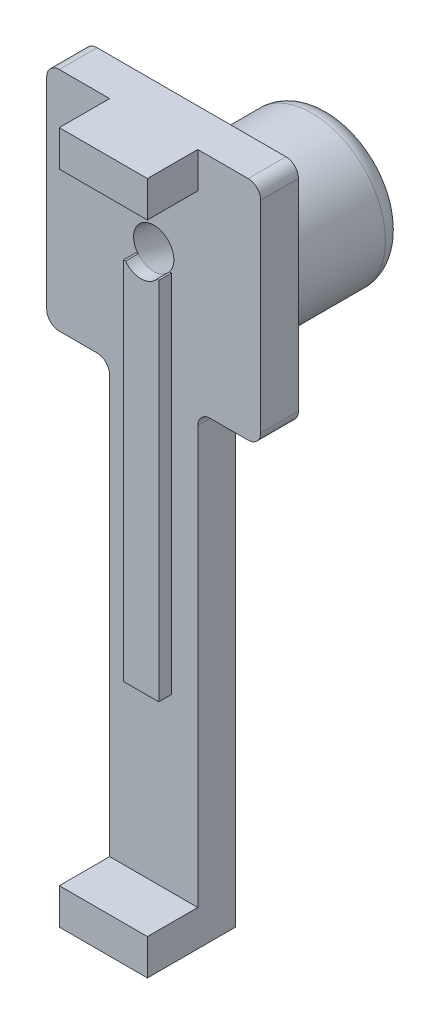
SolidWorks part; units mm, degrees
ref_plane "Front Plane" through (0, 0, 0) normal (0, 0, 1) x (1, 0, 0)
ref_plane "Top Plane" through (0, 0, 0) normal (0, 1, 0) x (1, 0, 0)
ref_plane "Right Plane" through (0, 0, 0) normal (1, 0, 0) x (0, 0, -1)
sketch "Sketch1" plane through (0, 0, 0) normal (0, 0, 1) x (1, 0, 0)
  line L1 (1.5, -15) -> (-1.5, -15)
  line L2 (1.5, -15) -> (1.5, 15)
  line L3 (1.5, 15) -> (-1.5, 15)
  line L4 (-1.5, -15) -> (-1.5, 15)
  line L5 (1.5, -15) -> (-1.5, 15) construction
  line L6 (1.5, 15) -> (-1.5, -15) construction
  line L7 (3.5, -18.4549) -> (-3.5, -18.4549)
  line L8 (3.5, -18.4549) -> (3.5, 36.5451)
  line L9 (3.5, 36.5451) -> (-3.5, 36.5451)
  line L10 (-3.5, -18.4549) -> (-3.5, 36.5451)
  line L11 (3.5, -18.4549) -> (-3.5, 36.5451) construction
  line L12 (3.5, 36.5451) -> (-3.5, -18.4549) construction
  point P0 (0, 0)
  point P6 (0, 9.0451)
  dimension "D1" = 3
  dimension "D2" = 30
  dimension "D3" = 55
  dimension "D4" = 7
extrude "Boss-Extrude1" add sketch "Sketch1" along normal blind 3 contours L10 L7 L8 L9 L1 L4 L3 L2 | L4 L1 L2 L3
sketch "Sketch2" plane through (0, 0, 3) normal (0, 0, 1) x (1, 0, 0)
  line L0 (3.5, -18.4549) -> (-3.5, -18.4549) construction
  line L1 (0, -2.0049) -> (0, -18.4549) construction
  line L16 (-1.4, -2.0049) -> (1.4, -2.0049)
  line L17 (-1.4, 26.9951) -> (-1.4, -2.0049)
  line L18 (1.4, 26.9951) -> (-1.4, 26.9951)
  line L19 (1.4, -2.0049) -> (1.4, 26.9951)
  point P0 (0, -2.0049)
  dimension "D1" = 16.45
  dimension "D2" = 29
  dimension "D3" = 2.8
extrude "Boss-Extrude2" add sketch "Sketch2" along normal blind 1
sketch "Sketch3" plane through (0, 0, 3) normal (0, 0, 1) x (1, 0, 0)
  line L0 (3.5, -18.4549) -> (3.5, 36.5451) construction
  line L1 (-3.5, 36.5451) -> (3.5, 36.5451)
  line L2 (-3.5, 36.5451) -> (-3.5, 33.6951)
  line L3 (-3.5, 33.6951) -> (3.5, 33.6951)
  line L4 (3.5, 36.5451) -> (3.5, 33.6951)
  line L5 (-3.5, -18.4549) -> (-3.5, 36.5451) construction
  line L6 (3.5, -18.4549) -> (-3.5, -18.4549)
  line L7 (3.5, -18.4549) -> (3.5, -15.6049)
  line L8 (3.5, -15.6049) -> (-3.5, -15.6049)
  line L9 (-3.5, -18.4549) -> (-3.5, -15.6049)
  dimension "D1" = 2.85
  dimension "D2" = 2.85
extrude "Boss-Extrude3" add sketch "Sketch3" along normal blind 4
sketch "Sketch4" plane through (-3.5, 0, 0) normal (-1, 0, 0) x (0, 0, 1)
  line L0 (3, -15.6049) -> (3, 33.6951) construction
  line L1 (0, 36.5451) -> (3, 36.5451)
  line L2 (0, 36.5451) -> (0, 18.5451)
  line L3 (0, 18.5451) -> (3, 18.5451)
  line L4 (3, 36.5451) -> (3, 18.5451)
  dimension "D1" = 18
extrude "Boss-Extrude4" add sketch "Sketch4" along normal blind 5
sketch "Sketch5" plane through (3.5, 0, 0) normal (1, 0, 0) x (0, 0, -1)
  line L4 (0, 36.5451) -> (-3, 36.5451)
  line L5 (-3, 36.5451) -> (-3, 18.5451)
  line L6 (-3, 18.5451) -> (0, 18.5451)
  line L7 (0, 18.5451) -> (0, 36.5451)
  line L8 (0, 36.5451) -> (-3, 36.5451)
  line L9 (-3, 36.5451) -> (-3, 18.5451)
  line L10 (-3, 18.5451) -> (0, 18.5451)
  line L11 (0, 18.5451) -> (0, 36.5451)
  dimension "D1" = 0
extrude "Boss-Extrude5" add sketch "Sketch5" along normal blind 5
sketch "Sketch7" plane through (0, 0, 3) normal (0, 0, 1) x (1, 0, 0)
  line L0 (-1.4, -2.0049) -> (1.4, -2.0049) construction
  circle A0 centre (0, 27.9951) radius 1.6
  dimension "D1" = 3.2
  dimension "D2" = 30
sketch "Sketch9" plane through (0, 0, 0) normal (0, 0, -1) x (-1, 0, 0)
  line L0 (0, 36.5451) -> (0, -18.4549) construction
  line L1 (-8.5, 36.5451) -> (8.5, 36.5451) construction
  line L2 (-3.5, -18.4549) -> (3.5, -18.4549) construction
  circle A0 centre (0, 25.1701) radius 5.85
  dimension "D1" = 11.7
  dimension "D2" = 11.375
extrude "Boss-Extrude7" add sketch "Sketch9" along normal blind 11.06
sketch "Sketch10" plane through (0, 0, -11.06) normal (0, 0, -1) x (-1, 0, 0)
  line L0 (0, 31.0201) -> (0, 19.3201)
  line L1 (-5.0662, 28.0951) -> (5.0662, 22.2451)
  line L2 (5.0662, 28.0951) -> (-5.0662, 22.2451)
  circle A3 centre (0, 25.1701) radius 5.85
  circle A4 centre (0, 25.1701) radius 5.85 construction
  dimension "D1" = 60
  dimension "D2" = 60
fillet "Fillet1" radius 1.5 1 edges at (-5.85, 25.1701, -11.06)
fillet "Fillet2" radius 1 6 edges at (-3.5, 18.5451, 1.5) (-8.5, 18.5451, 1.5) (-8.5, 36.5451, 1.5) (8.5, 36.5451, 1.5) (8.5, 18.5451, 1.5) (3.5, 18.5451, 1.5)
sketch "Sketch11" plane through (0, 0, -11.06) normal (0, 0, -1) x (-1, 0, 0)
  circle A0 centre (0, 25.1701) radius 3.4369
ref_plane "Plane1" through (0, 0, 0) normal (1, 0, 0) x (0, 0, -1)
loft "Cut-Loft6" cut profiles "Sketch11", "Sketch7"
sketch "Sketch18" plane through (0, 0, 3) normal (0, 0, -1) x (-1, 0, 0)
  line L1 (1.2491, 26.9951) -> (-1.2488, 26.9951)
  line L2 (1.2491, 26.9951) -> (-1.2488, 26.9951)
  arc A0 (-1.2488, 26.9951) -> (1.2491, 26.9951) centre (0.0002, 27.9951) ccw
  arc A1 (-1.2488, 26.9951) -> (1.2491, 26.9951) centre (0.0002, 27.9951) ccw
  dimension "D1" = 0
extrude "Cut-Extrude1" cut sketch "Sketch18" against normal blind 10
sketch "Sketch19" plane through (0, 0, 0) normal (0, 0, -1) x (-1, 0, 0)
  line L0 (-3.5, -18.4549) -> (3.5, -18.4549) construction
  line L1 (3.5, -18.4549) -> (3.5, 17.5451) construction
  circle A0 centre (0, -16.4549) radius 0.5
  circle A1 centre (0, -14.4549) radius 0.5
  point P4 (0, 0)
  point P5 (0, 0)
  point P10 (0, 0)
  point P12 (-4.1584, -17.475)
  dimension "D1" = 2
  dimension "D2" = 2
  dimension "D3" = 3.5
extrude "Cut-Extrude2" cut sketch "Sketch19" against normal blind 2.5
